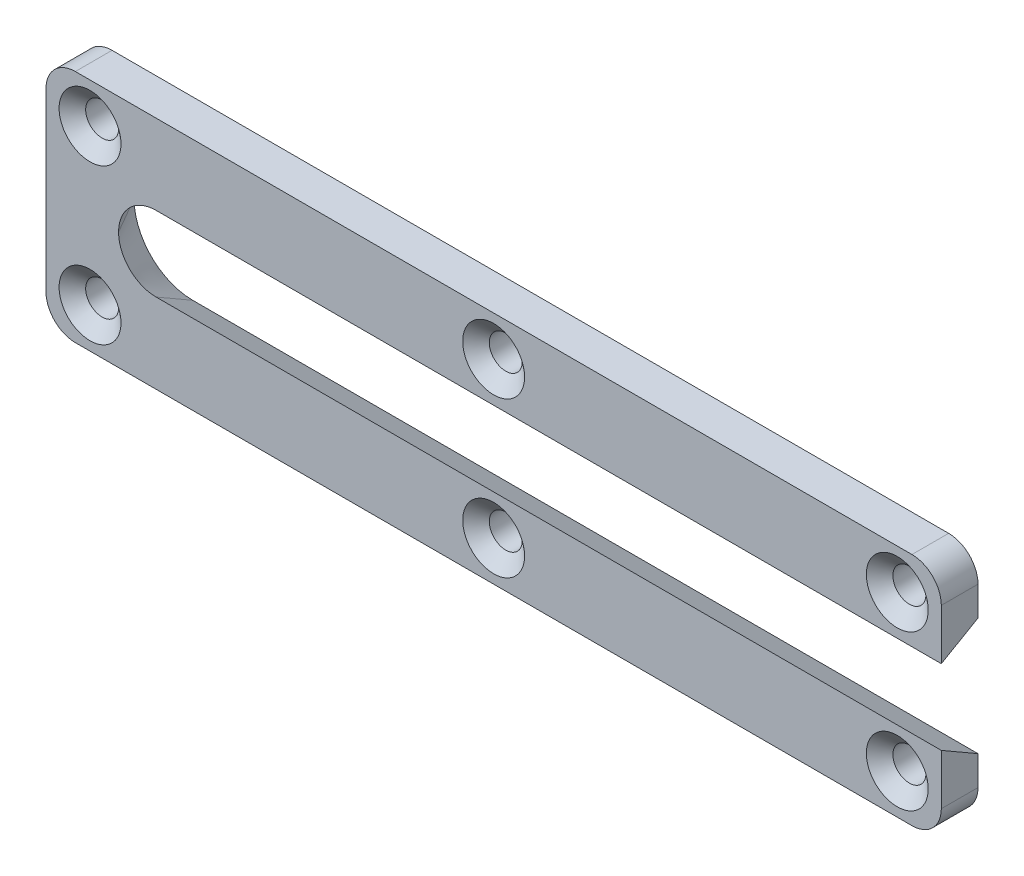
SolidWorks part; units mm, degrees
ref_plane "Front" through (0, 0, 0) normal (0, 0, 1) x (1, 0, 0)
ref_plane "Top" through (0, 0, 0) normal (0, 1, 0) x (1, 0, 0)
ref_plane "Right" through (0, 0, 0) normal (1, 0, 0) x (0, 0, -1)
sketch "Sketch1" plane through (0, 0, 0) normal (0, 0, 1) x (1, 0, 0)
  line L0 (0, 0) -> (-91.6833, 0) construction
  line L1 (-122, 16) -> (0, 16)
  line L2 (-122, 16) -> (-122, -16)
  line L3 (-122, -16) -> (0, -16)
  line L4 (0, 16) -> (0, -16)
  dimension "D1" = 32
  dimension "D2" = 122
extrude "Extrude1" add sketch "Sketch1" along normal blind 5
sketch "Sketch2" plane through (0, 0, 0) normal (0, 0, -1) x (-1, 0, 0)
  line L0 (0, -16) -> (0, 16) construction
  line L1 (0, 3) -> (110, 3)
  line L2 (0, 3) -> (0, -3)
  line L3 (0, -3) -> (110, -3)
  line L4 (110, 3) -> (110, -3)
  dimension "D1" = 6
  dimension "D2" = 110
extrude "Extrude2" cut sketch "Sketch2" against normal through all
fillet "Fillet1" radius 3 2 edges at (-110, -3, 2.5) (-110, 3, 2.5)
chamfer "Chamfer1" distance 5 angle 60 4 edges at (-53.5, -3, 0) (-109.1213, -2.1213, 0) (-109.1213, 2.1213, 0) (-53.5, 3, 0)
hole_wizard "CSK for #8 Flat Head Machine Screw (100)1" positions "Sketch5" profile "Sketch3" countersink size "#8" standard "ANSI Inch"
sketch "Sketch5" plane through (0, 0, 5) normal (0, 0, 1) x (1, 0, 0)
  line L0 (0, 10.5566) -> (-108.1675, 10.5566) construction
  line L1 (0, 5.1132) -> (0, 16) construction
  line L2 (-122, 16) -> (-122, -16) construction
  point P0 (-116, 10.5566)
  dimension "D1" = 6
sketch "Sketch3" plane through (-116, 10.5566, 5) normal (1, 0, 0) x (0, -1, 0)
  line L0 (0, 0) -> (0, 5)
  line L1 (0, 5) -> (2.2479, 5)
  line L2 (2.2479, 5) -> (2.2479, 1.6518)
  line L3 (2.2479, 1.6518) -> (4.2164, 0)
  line L5 (4.2164, 0) -> (0, 0)
  line L6 (-2.2479, 1.6518) -> (-4.2164, 0) construction
  line L11 (0, -6.35) -> (0, 107.95) construction
  dimension "Thru Hole Dia." = 4.4958
  dimension "Thru Hole Depth" = 5
  dimension "Near C'Sink Dia." = 8.4328
  dimension "Near C'Sink Angle" = 100
fillet "Fillet2" radius 4 4 edges at (0, -16, 2.5) (0, 16, 2.5) (-122, -16, 2.5) (-122, 16, 2.5)
mirror "Mirror1" about plane through (0, 0, 0) normal (0, 1, 0) of "CSK for #8 Flat Head Machine Screw (100)1"
pattern_linear "LPattern1" count 3 spacing 55 along (1, 0, 0) of "Mirror1", "CSK for #8 Flat Head Machine Screw (100)1"
